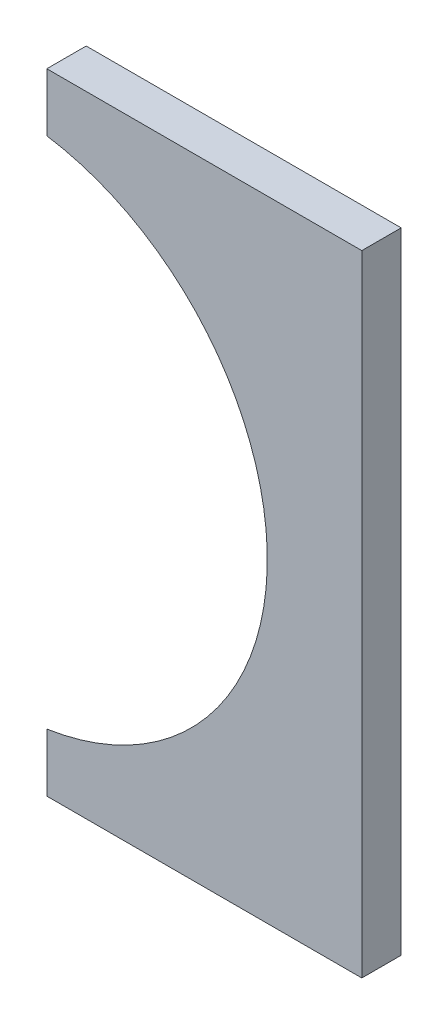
SolidWorks part; units mm, degrees
ref_plane "Front Plane" through (0, 0, 0) normal (0, 0, 1) x (1, 0, 0)
ref_plane "Top Plane" through (0, 0, 0) normal (0, 1, 0) x (1, 0, 0)
ref_plane "Right Plane" through (0, 0, 0) normal (1, 0, 0) x (0, 0, -1)
sketch "Sketch1" plane through (0, 0, 0) normal (0, 0, 1) x (1, 0, 0)
  line L1 (5, -40) -> (-5, -40)
  line L2 (5, -40) -> (5, 40)
  line L3 (5, 40) -> (-5, 40)
  line L4 (-5, -40) -> (-5, 40)
  line L5 (5, -40) -> (-5, 40) construction
  line L6 (5, 40) -> (-5, -40) construction
  line L7 (5, -40) -> (45, -40)
  line L8 (5, -40) -> (5, 40)
  line L9 (5, 40) -> (45, 40)
  line L10 (45, -40) -> (45, 40)
  line L11 (5, -40) -> (45, 40) construction
  line L12 (5, 40) -> (45, -40) construction
  circle A1 centre (0, 0) radius 33
  point P9 (25, 0)
  dimension "D1" = 10
  dimension "D2" = 80
  dimension "D3" = 40
extrude "Boss-Extrude1" add sketch "Sketch1" along normal blind 5 contours A1 L2 L7 L10 L9
chamfer "Chamfer1" distance 5 angle 45 1 edges at (33, 0, 0)
ref_plane "Plane1" through (0, 0, 0) normal (0, -1, 0) x (-1, 0, 0)
